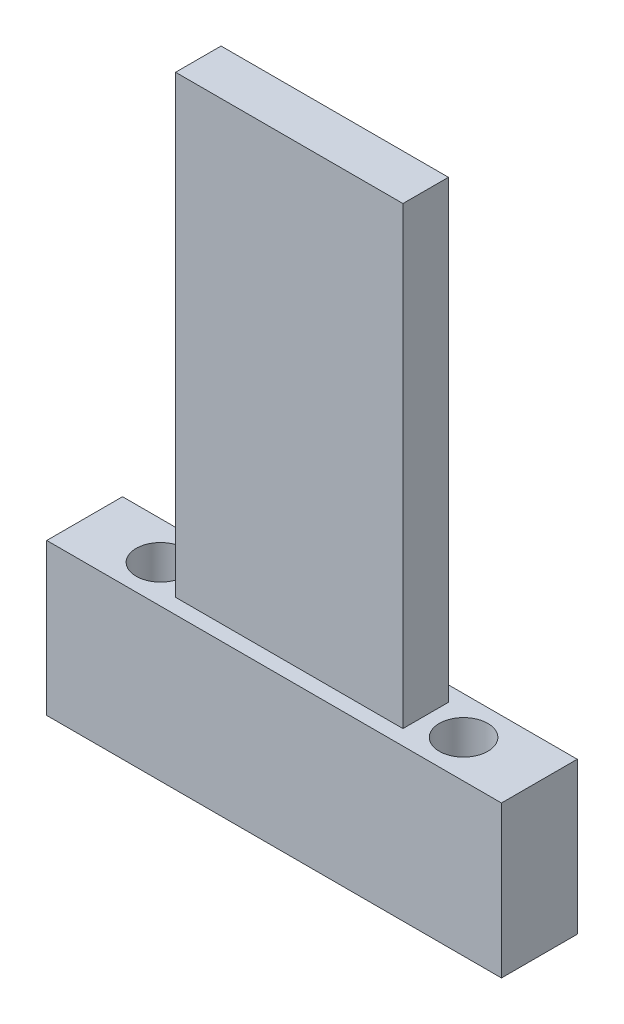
SolidWorks part; units mm, degrees
ref_plane "Plano frontal" through (0, 0, 0) normal (0, 0, 1) x (1, 0, 0)
ref_plane "Plano superior" through (0, 0, 0) normal (0, 1, 0) x (1, 0, 0)
ref_plane "Plano direito" through (0, 0, 0) normal (1, 0, 0) x (0, 0, -1)
sketch "Esboço1" plane through (0, 0, 0) normal (0, 1, 0) x (1, 0, 0)
  line L1 (-15, -2.5) -> (15, -2.5)
  line L2 (-15, -2.5) -> (-15, 2.5)
  line L3 (-15, 2.5) -> (15, 2.5)
  line L4 (15, -2.5) -> (15, 2.5)
  point P4 (0, 2.5)
  point P6 (-15, 0)
  dimension "D1" = 30
  dimension "D2" = 5
extrude "Ressalto-extrusão1" add sketch "Esboço1" along normal blind 10
sketch "Esboço2" plane through (0, 10, 0) normal (0, 1, 0) x (1, 0, 0)
  line L1 (-7.5, -1.5) -> (7.5, -1.5)
  line L2 (-7.5, -1.5) -> (-7.5, 1.5)
  line L3 (-7.5, 1.5) -> (7.5, 1.5)
  line L4 (7.5, -1.5) -> (7.5, 1.5)
  point P4 (-7.5, 0)
  point P8 (0, -1.5)
  point P10 (0, 0)
  point P11 (0, 0)
  dimension "D1" = 15
  dimension "D2" = 3
extrude "Ressalto-extrusão2" add sketch "Esboço2" along normal blind 30
sketch "Esboço3" plane through (0, 10, 0) normal (0, 1, 0) x (1, 0, 0)
  line L0 (-15, 2.5) -> (-15, -2.5) construction
  line L1 (0, 4.0435) -> (0, -3.8654) construction
  circle A0 centre (-10, 0) radius 1.6
  circle A1 centre (10, 0) radius 1.6
  dimension "D1" = 3.2
  dimension "D2" = 5
extrude "Corte-extrusão1" cut sketch "Esboço3" against normal through all
